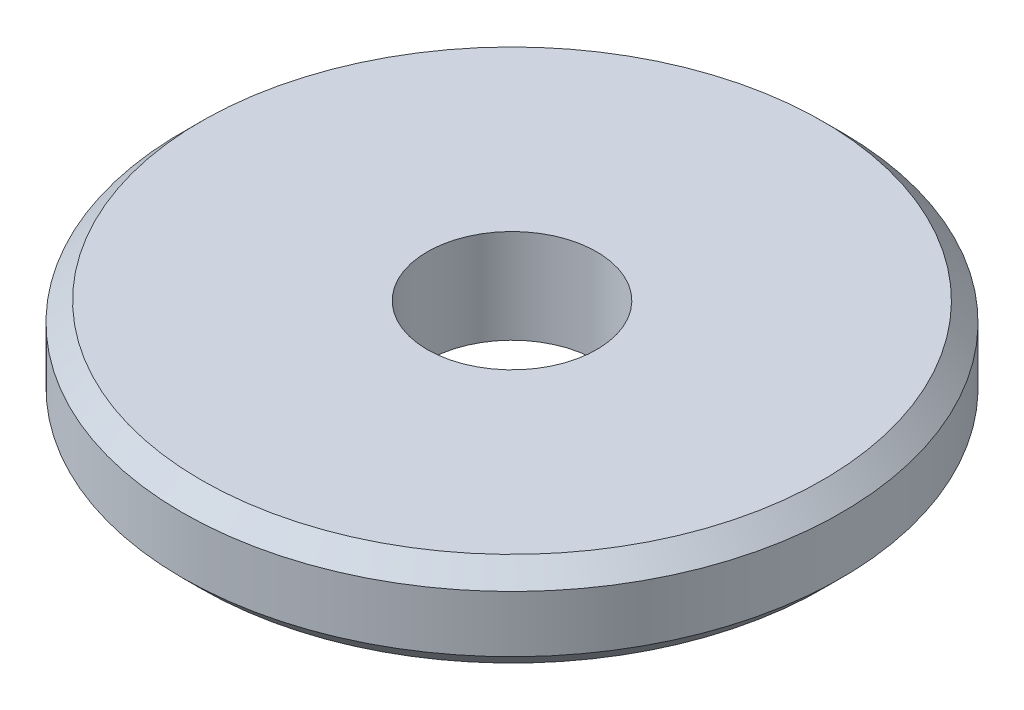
SolidWorks part; units mm, degrees
ref_plane "Front Plane" through (0, 0, 0) normal (0, 0, 1) x (1, 0, 0)
ref_plane "Top Plane" through (0, 0, 0) normal (0, 1, 0) x (1, 0, 0)
ref_plane "Right Plane" through (0, 0, 0) normal (1, 0, 0) x (0, 0, -1)
sketch "Sketch1" plane through (0, 0, 0) normal (0, 1, 0) x (1, 0, 0)
  circle A0 centre (0, 0) radius 17.5
  circle A1 centre (0, 0) radius 4.5
  dimension "D1" = 9
  dimension "D2" = 35
extrude "Extrude1" add sketch "Sketch1" along normal blind 5
chamfer "Chamfer1" distance 1 angle 45 2 edges at (0, 0, 17.5) (0, 5, 17.5)
